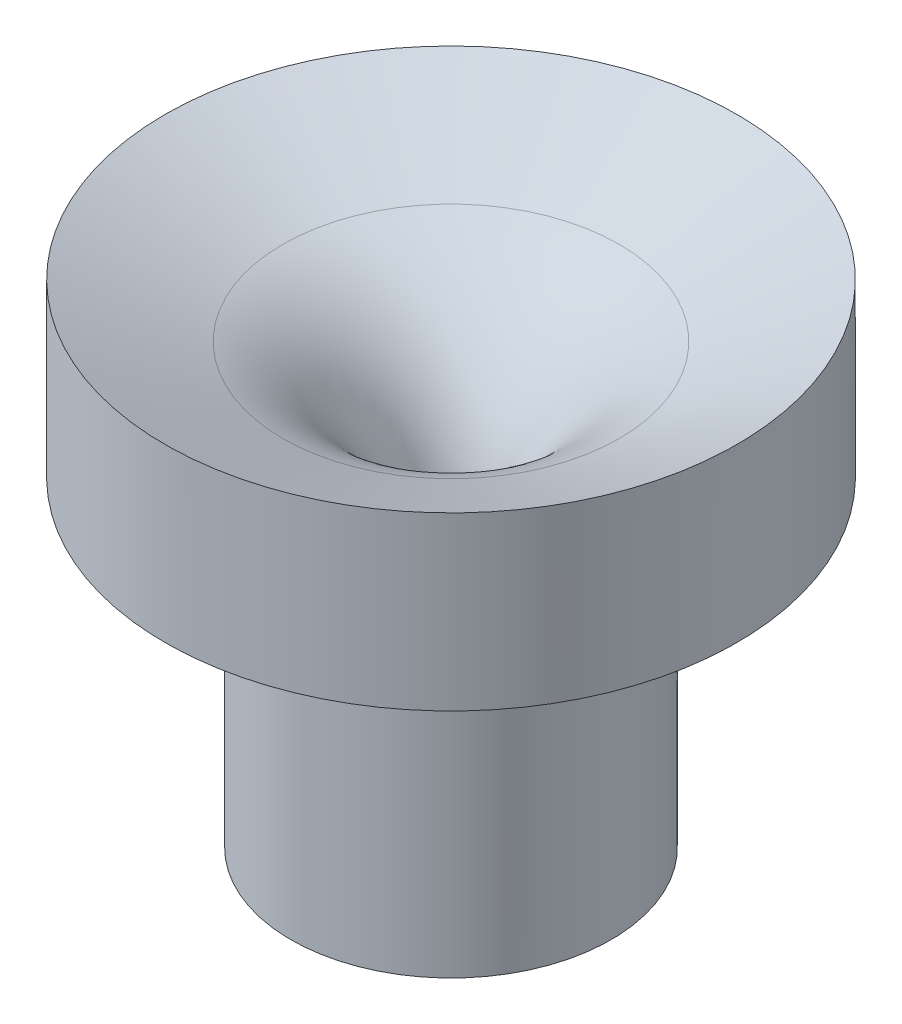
SolidWorks part; units mm, degrees
ref_plane "Front Plane" through (0, 0, 0) normal (0, 0, 1) x (1, 0, 0)
ref_plane "Top Plane" through (0, 0, 0) normal (0, 1, 0) x (1, 0, 0)
ref_plane "Right Plane" through (0, 0, 0) normal (1, 0, 0) x (0, 0, -1)
sketch "Sketch1" plane through (0, 0, 0) normal (0, 0, 1) x (1, 0, 0)
  line L0 (12.3037, 33.5577) -> (16.8037, 33.5577)
  line L1 (6.8037, 55.0577) -> (6.8037, 49.0577)
  line L2 (6.8037, 49.0577) -> (8.3037, 49.0577)
  line L3 (8.3037, 49.0577) -> (8.3037, 47.5577)
  line L4 (8.3037, 47.5577) -> (12.3037, 47.5577)
  line L5 (12.3037, 47.5577) -> (12.3037, 33.5577)
  line L6 (17.8037, 50.0443) -> (17.8037, 37.5577)
  line L7 (19.3037, 57.2842) -> (19.3037, 18.9248) construction
  line L8 (6.8037, 55.0577) -> (17.8037, 50.0443)
  line L11 (17.8037, 37.5577) -> (16.8037, 33.5577)
  dimension "D1" = 6
  dimension "D2" = 1.5
  dimension "D3" = 1.5
  dimension "D4" = 4
  dimension "D5" = 14
  dimension "D6" = 2.5
  dimension "D7" = 1
  dimension "D8" = 4.5
revolve "Revolve1" add sketch "Sketch1" angle 360 about L7
chamfer "Chamfer1" distance 2 angle 45 1 edges at (12.3037, 47.5577, 0)
fillet "Fillet1" radius 10 1 edges at (17.8037, 50.0443, 0)
sketch "Sketch2" plane through (0, 0, 0) normal (0, 0, 1) x (1, 0, 0)
  line L0 (19.3037, 33.5577) -> (19.3037, 41.6537) construction
  line L1 (6.8037, 49.0577) -> (8.3037, 49.0577)
  line L2 (6.8037, 49.0577) -> (6.8037, 47.5577)
  line L3 (6.8037, 47.5577) -> (8.3037, 47.5577)
  line L4 (8.3037, 49.0577) -> (8.3037, 47.5577)
  line L5 (12.3037, 33.5577) -> (26.3037, 33.5577) construction
revolve "Revolve3" add sketch "Sketch2" angle 360 about L0
